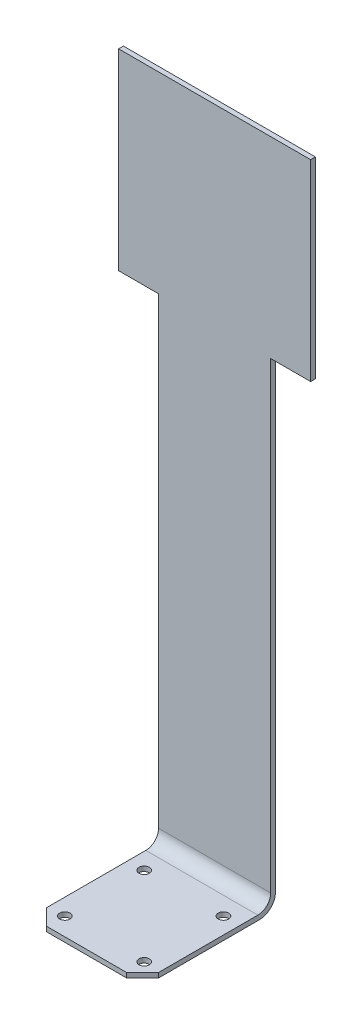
SolidWorks part; units mm, degrees
ref_plane "Plan de face" through (0, 0, 0) normal (0, 0, 1) x (1, 0, 0)
ref_plane "Plan de dessus" through (0, 0, 0) normal (0, 1, 0) x (1, 0, 0)
ref_plane "Plan de droite" through (0, 0, 0) normal (1, 0, 0) x (0, 0, -1)
sketch "Esquisse1" plane through (0, 0, 0) normal (0, 0, 1) x (1, 0, 0)
  line L0 (-35, -60) -> (-35, -360)
  line L1 (-60, -60) -> (-35, -60)
  line L2 (-60, -60) -> (-60, 60)
  line L3 (-60, 60) -> (60, 60)
  line L4 (60, -60) -> (60, 60)
  line L5 (-60, -60) -> (60, 60) construction
  line L6 (-60, 60) -> (60, -60) construction
  line L7 (-35, -360) -> (35, -360)
  line L8 (35, -360) -> (35, -60)
  line L9 (35, -60) -> (60, -60)
  point P0 (0, 0)
  dimension "D1" = 120
  dimension "D2" = 120
  dimension "D3" = 300
  dimension "D4" = 70
extrude "Boss.-Extru.1" add sketch "Esquisse1" along normal mid plane 3
sketch "Esquisse2" plane through (0, 60, 0) normal (0, 1, 0) x (1, 0, 0)
  circle A0 centre (-74.9248, 0) radius 15
  circle A1 centre (74.9248, 0) radius 15
  dimension "D1" = 30
extrude "Enlèv. mat.-Extru.1" cut sketch "Esquisse2" against normal through all
sketch "Esquisse4" plane through (0, 0, 1.5) normal (0, 0, 1) x (1, 0, 0)
  line L0 (35, -360) -> (35, -60) construction
  line L1 (-35, -360) -> (35, -360)
  line L2 (-35, -360) -> (-35, -357)
  line L3 (-35, -357) -> (35, -357)
  line L4 (35, -360) -> (35, -357)
  dimension "D1" = 3
extrude "Boss.-Extru.2" add sketch "Esquisse4" along normal blind 80
fillet "Congé1" radius 10 1 edges at (0, -360, -1.5)
fillet "Congé2" radius 8 1 edges
sketch "Esquisse5" plane through (0, -357, 0) normal (0, 1, 0) x (1, 0, 0)
  line L0 (0, -81.5) -> (0, -12.2536) construction
  line L1 (35, -81.5) -> (-35, -81.5) construction
  line L2 (0, -45.5) -> (-24.7487, -20.7513) construction
  line L3 (35, -81.5) -> (35, -9.5) construction
  line L4 (35, -45.5) -> (-35, -45.5) construction
  line L5 (-35, -81.5) -> (-35, -9.5) construction
  circle A0 centre (-24.7487, -20.7513) radius 3.25
  circle A1 centre (0, -45.5) radius 35 construction
  circle A2 centre (24.7487, -20.7513) radius 3.25
  circle A3 centre (24.7487, -70.2487) radius 3.25
  circle A4 centre (-24.7487, -70.2487) radius 3.25
  point P24 (2.5, -43)
  point P25 (0, -45.5)
  dimension "D2" = 45
  dimension "D1" = 70
  dimension "D3" = 6.5
  dimension "D4" = 4
extrude "Enlèv. mat.-Extru.2" cut sketch "Esquisse5" against normal through all
chamfer "Chanfrein1" distance 10 angle 45 2 edges at (35, -358.5, 81.5) (-35, -358.5, 81.5)
